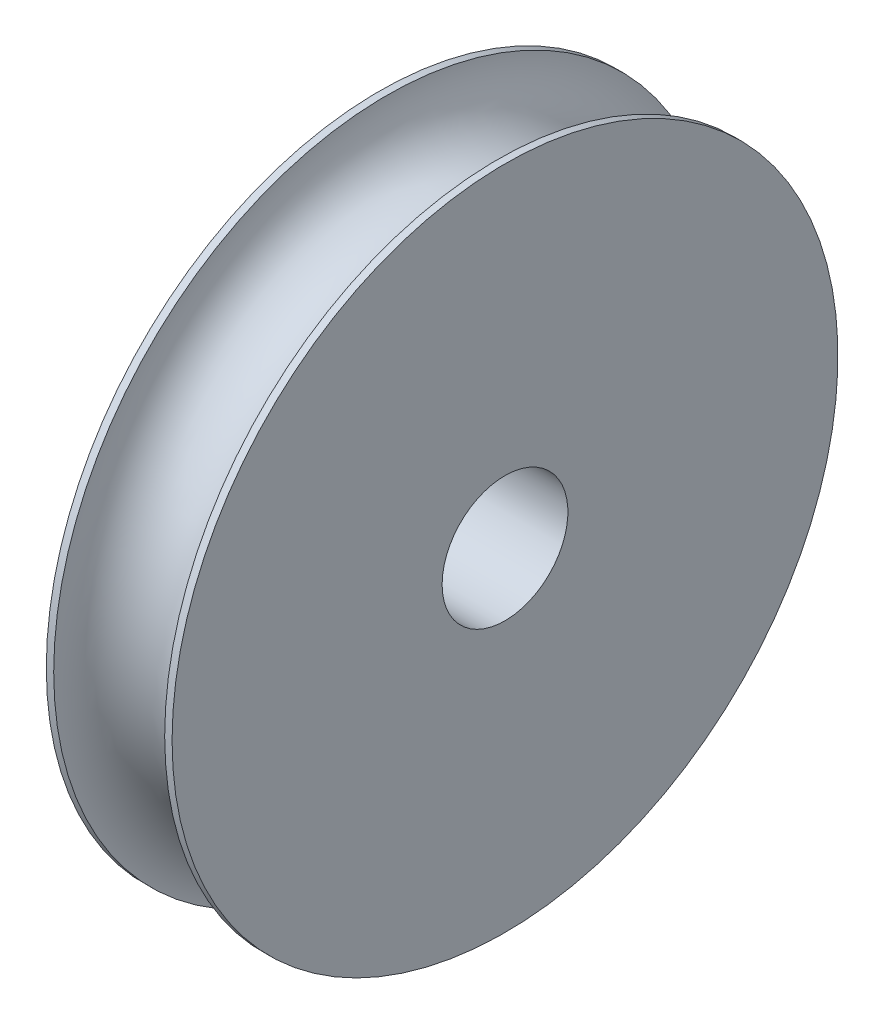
SolidWorks part; units mm, degrees
ref_plane "Plan de face" through (0, 0, 0) normal (0, 0, 1) x (1, 0, 0)
ref_plane "Plan de dessus" through (0, 0, 0) normal (0, 1, 0) x (1, 0, 0)
ref_plane "Plan de droite" through (0, 0, 0) normal (1, 0, 0) x (0, 0, -1)
sketch "Esquisse1" plane through (0, 0, 0) normal (0, 0, 1) x (1, 0, 0)
  line L0 (0, 0) -> (75.7163, 0) construction
  line L1 (0, 17) -> (0, 90)
  line L2 (0, 90) -> (2, 90)
  line L3 (34, 90) -> (34, 17)
  line L4 (34, 90) -> (32, 90)
  line L5 (0, 17) -> (34, 17)
  arc A0 (2, 90) -> (32, 90) centre (17, 90) ccw
  dimension "D1" = 34
  dimension "D2" = 2
  dimension "D3" = 2
  dimension "D5" = 34
revolve "Révolution1" add sketch "Esquisse1" angle 360 about L0
